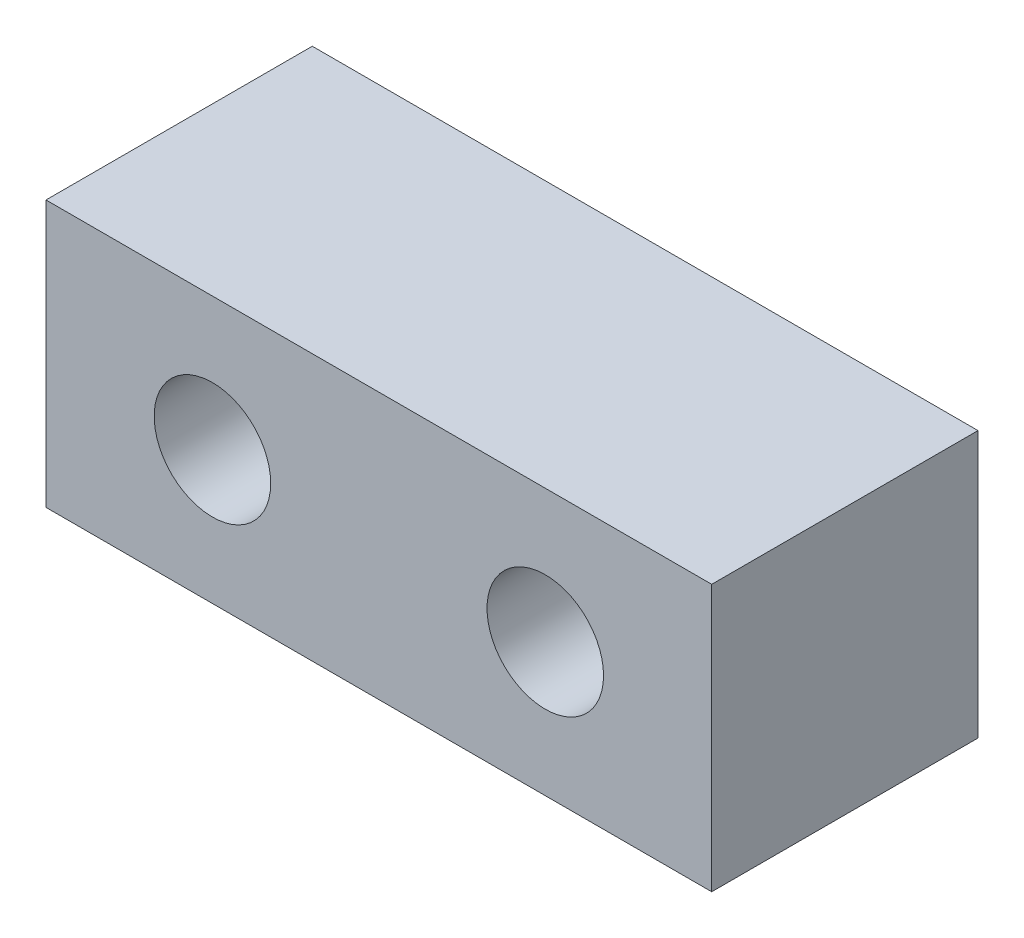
SolidWorks part; units mm, degrees
ref_plane "Front Plane" through (0, 0, 0) normal (0, 0, 1) x (1, 0, 0)
ref_plane "Top Plane" through (0, 0, 0) normal (0, 1, 0) x (1, 0, 0)
ref_plane "Right Plane" through (0, 0, 0) normal (1, 0, 0) x (0, 0, -1)
sketch "Sketch1" plane through (0, 0, 0) normal (0, 0, 1) x (1, 0, 0)
  line L0 (0, 0) -> (0, 31.2611) construction
  line L1 (-15.875, -6.35) -> (15.875, -6.35)
  line L2 (15.875, -6.35) -> (15.875, 6.35)
  line L3 (15.875, 6.35) -> (-15.875, 6.35)
  line L4 (-15.875, 6.35) -> (-15.875, -6.35)
  line L5 (0, 0) -> (4.5471, 0) construction
  circle A0 centre (-7.9375, 0) radius 1.5875 construction
  circle A1 centre (7.9375, 0) radius 1.5875 construction
  dimension "D1" = 3.175
  dimension "D2" = 15.875
  dimension "D3" = 31.75
  dimension "D4" = 12.7
extrude "Boss-Extrude1" add sketch "Sketch1" along normal blind 12.7
hole_wizard "CBORE for #4 Socket Head Cap Screw1" positions "Sketch3" profile "Sketch2" counterbore size "#4" standard "ANSI Inch"
sketch "Sketch3" plane through (0, 0, 12.7) normal (0, 0, 1) x (1, 0, 0)
  point P0 (-7.9375, 0)
  point P3 (7.9375, 0)
sketch "Sketch2" plane through (-7.9375, 0, 12.7) normal (1, 0, 0) x (0, -1, 0)
  line L0 (0, 0) -> (0, 12.7)
  line L1 (0, 12.7) -> (1.4732, 12.7)
  line L3 (1.4732, 12.7) -> (1.4732, 6.35)
  line L4 (1.4732, 6.35) -> (2.7788, 6.35)
  line L5 (2.7788, 6.35) -> (2.7788, 0)
  line L7 (2.7788, 0) -> (0, 0)
  line L11 (0, -6.35) -> (0, 107.95) construction
  dimension "Thru Hole Dia." = 2.9464
  dimension "Thru Hole Depth" = 12.7
  dimension "C'Bore Dia." = 5.5575
  dimension "C'Bore Depth" = 6.35
